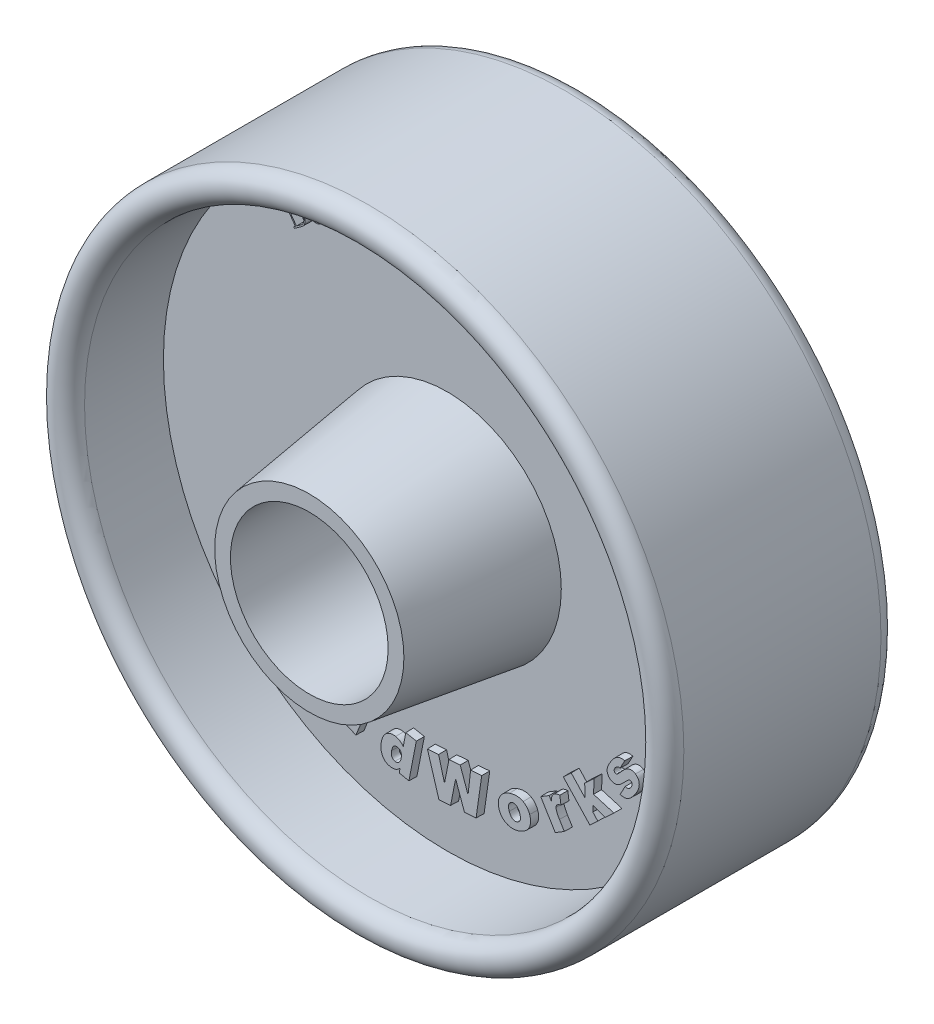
SolidWorks part; units mm, degrees
ref_plane "Front" through (0, 0, 0) normal (0, 0, 1) x (1, 0, 0)
ref_plane "Top" through (0, 0, 0) normal (0, 1, 0) x (1, 0, 0)
ref_plane "Right" through (0, 0, 0) normal (1, 0, 0) x (0, 0, -1)
sketch "Sketch1" plane through (0, 0, 0) normal (1, 0, 0) x (0, 0, -1)
  line L0 (0, 0) -> (0, 44.466) construction
  line L1 (-20, 10) -> (20, 10)
  line L2 (20, 10) -> (20, 12)
  line L3 (-20, 10) -> (-20, 12)
  line L4 (20, 12) -> (2.5, 14.4595)
  line L5 (-20, 12) -> (-2.5, 14.4595)
  line L6 (2.5, 14.4595) -> (2.5, 36)
  line L7 (-2.5, 14.4595) -> (-2.5, 36)
  line L8 (2.5, 36) -> (12.5, 36)
  line L9 (-2.5, 36) -> (-12.5, 36)
  line L10 (-12.5, 40) -> (12.5, 40)
  line L11 (0, 0) -> (25.2657, 0) construction
  arc A0 (12.5, 40) -> (12.5, 36) centre (12.5, 38) cw
  arc A1 (-12.5, 40) -> (-12.5, 36) centre (-12.5, 38) ccw
  point P6 (0, 10)
  point P17 (0, 40)
  dimension "D6" = 29
  dimension "D1" = 24
  dimension "D2" = 20
  dimension "D3" = 80
  dimension "D4" = 4
  dimension "D5" = 8
  dimension "D7" = 40
  dimension "D8" = 5
revolve "Base-Revolve" add sketch "Sketch1" angle 360 about L11
sketch "Sketch2"
  dimension "D1" = 60
  dimension "D2" = 30
  dimension "D3" = 40
extrude "Boss-Extrude1" add sketch "Sketch2" along normal blind 1 draft 1
